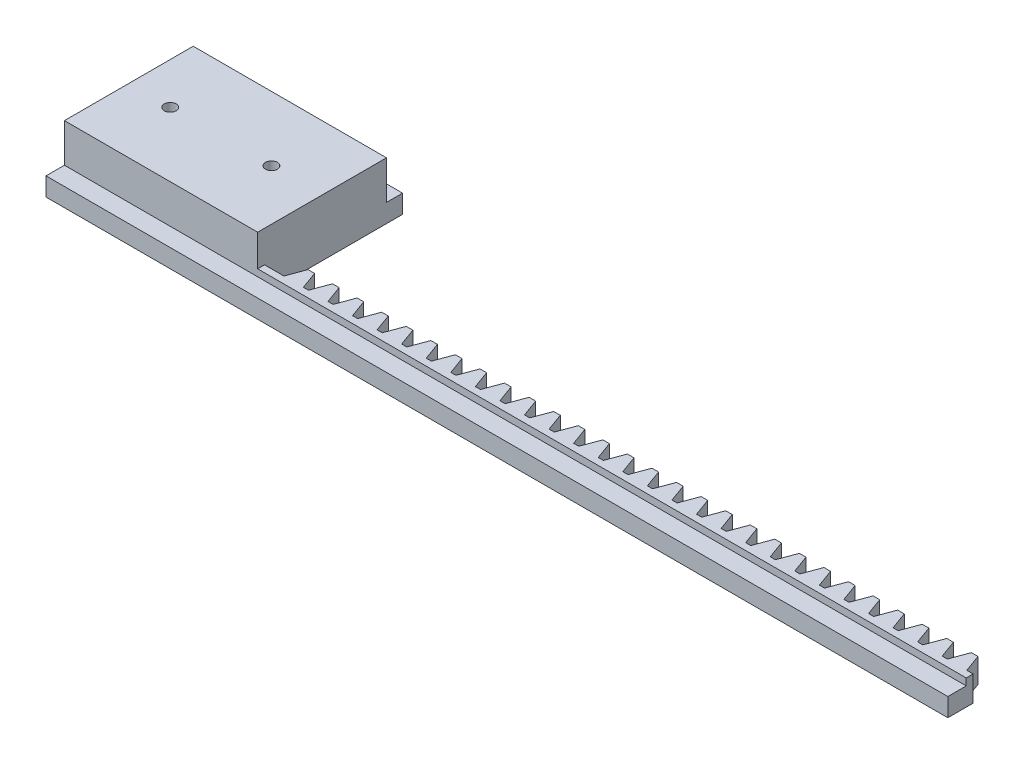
SolidWorks part; units mm, degrees
ref_plane "Front Plane" through (0, 0, 0) normal (0, 0, 1) x (1, 0, 0)
ref_plane "Top Plane" through (0, 0, 0) normal (0, 1, 0) x (1, 0, 0)
ref_plane "Right Plane" through (0, 0, 0) normal (1, 0, 0) x (0, 0, -1)
sketch "Sketch1" plane through (0, 0, 0) normal (0, 1, 0) x (1, 0, 0)
  line L0 (0, 0) -> (50, 0) construction
  line L1 (23.5675, 1.7) -> (25, 1.7)
  line L3 (25, 1.7) -> (26.3922, -2.125)
  line L4 (25, 1.7) -> (25, -12.1658) construction
  line L5 (25.6187, 0) -> (22.9487, 0) construction
  line L6 (24.2837, 0) -> (24.2837, 0.9173) construction
  line L7 (23.5675, 1.7) -> (22.1616, -2.125)
  line L8 (0, 1.7) -> (50, 1.7) construction
  line L9 (28.9075, 1.7) -> (30.34, 1.7)
  line L10 (28.9075, 1.7) -> (27.5016, -2.125)
  line L11 (30.34, 1.7) -> (31.7322, -2.125)
  line L12 (34.2475, 1.7) -> (35.68, 1.7)
  line L13 (34.2475, 1.7) -> (32.8416, -2.125)
  line L14 (35.68, 1.7) -> (37.0722, -2.125)
  line L15 (39.5875, 1.7) -> (41.02, 1.7)
  line L16 (39.5875, 1.7) -> (38.1816, -2.125)
  line L17 (41.02, 1.7) -> (42.4122, -2.125)
  line L18 (44.9275, 1.7) -> (46.36, 1.7)
  line L19 (44.9275, 1.7) -> (43.5216, -2.125)
  line L20 (46.36, 1.7) -> (47.7522, -2.125)
  line L21 (50.2675, 1.7) -> (51.7, 1.7)
  line L22 (50.2675, 1.7) -> (48.8616, -2.125)
  line L23 (51.7, 1.7) -> (53.0922, -2.125)
  line L24 (55.6075, 1.7) -> (57.04, 1.7)
  line L25 (55.6075, 1.7) -> (54.2016, -2.125)
  line L26 (57.04, 1.7) -> (58.4322, -2.125)
  line L27 (60.9475, 1.7) -> (62.38, 1.7)
  line L28 (60.9475, 1.7) -> (59.5416, -2.125)
  line L29 (62.38, 1.7) -> (63.7722, -2.125)
  line L30 (66.2875, 1.7) -> (67.72, 1.7)
  line L31 (66.2875, 1.7) -> (64.8816, -2.125)
  line L32 (67.72, 1.7) -> (69.1122, -2.125)
  line L33 (71.6275, 1.7) -> (73.06, 1.7)
  line L34 (71.6275, 1.7) -> (70.2216, -2.125)
  line L35 (73.06, 1.7) -> (74.4522, -2.125)
  line L36 (76.9675, 1.7) -> (78.4, 1.7)
  line L37 (76.9675, 1.7) -> (75.5616, -2.125)
  line L38 (78.4, 1.7) -> (79.7922, -2.125)
  line L39 (82.3075, 1.7) -> (83.74, 1.7)
  line L40 (82.3075, 1.7) -> (80.9016, -2.125)
  line L41 (83.74, 1.7) -> (85.1322, -2.125)
  line L42 (87.6475, 1.7) -> (89.08, 1.7)
  line L43 (87.6475, 1.7) -> (86.2416, -2.125)
  line L44 (89.08, 1.7) -> (90.4722, -2.125)
  line L45 (92.9875, 1.7) -> (94.42, 1.7)
  line L46 (92.9875, 1.7) -> (91.5816, -2.125)
  line L47 (94.42, 1.7) -> (95.8122, -2.125)
  line L48 (98.3275, 1.7) -> (99.76, 1.7)
  line L49 (98.3275, 1.7) -> (96.9216, -2.125)
  line L50 (99.76, 1.7) -> (101.1522, -2.125)
  line L51 (103.6675, 1.7) -> (105.1, 1.7)
  line L52 (103.6675, 1.7) -> (102.2616, -2.125)
  line L53 (105.1, 1.7) -> (106.4922, -2.125)
  line L54 (109.0075, 1.7) -> (110.44, 1.7)
  line L55 (109.0075, 1.7) -> (107.6016, -2.125)
  line L56 (110.44, 1.7) -> (111.8322, -2.125)
  line L57 (114.3475, 1.7) -> (115.78, 1.7)
  line L58 (114.3475, 1.7) -> (112.9416, -2.125)
  line L59 (115.78, 1.7) -> (117.1722, -2.125)
  line L60 (119.6875, 1.7) -> (121.12, 1.7)
  line L61 (119.6875, 1.7) -> (118.2816, -2.125)
  line L62 (121.12, 1.7) -> (122.5122, -2.125)
  line L63 (125.0275, 1.7) -> (126.46, 1.7)
  line L64 (125.0275, 1.7) -> (123.6216, -2.125)
  line L65 (126.46, 1.7) -> (127.8522, -2.125)
  line L66 (130.3675, 1.7) -> (131.8, 1.7)
  line L67 (130.3675, 1.7) -> (128.9616, -2.125)
  line L68 (131.8, 1.7) -> (133.1922, -2.125)
  line L69 (135.7075, 1.7) -> (137.14, 1.7)
  line L70 (135.7075, 1.7) -> (134.3016, -2.125)
  line L71 (137.14, 1.7) -> (138.5322, -2.125)
  line L72 (141.0475, 1.7) -> (142.48, 1.7)
  line L73 (141.0475, 1.7) -> (139.6416, -2.125)
  line L74 (142.48, 1.7) -> (143.8722, -2.125)
  line L75 (146.3875, 1.7) -> (147.82, 1.7)
  line L76 (146.3875, 1.7) -> (144.9816, -2.125)
  line L77 (147.82, 1.7) -> (149.2122, -2.125)
  line L78 (151.7275, 1.7) -> (153.16, 1.7)
  line L79 (151.7275, 1.7) -> (150.3216, -2.125)
  line L80 (153.16, 1.7) -> (154.5522, -2.125)
  line L81 (157.0675, 1.7) -> (158.5, 1.7)
  line L82 (157.0675, 1.7) -> (155.6616, -2.125)
  line L83 (158.5, 1.7) -> (159.8922, -2.125)
  line L84 (162.4075, 1.7) -> (163.84, 1.7)
  line L85 (162.4075, 1.7) -> (161.0016, -2.125)
  line L86 (163.84, 1.7) -> (165.2322, -2.125)
  line L87 (167.7475, 1.7) -> (169.18, 1.7)
  line L88 (167.7475, 1.7) -> (166.3416, -2.125)
  line L89 (169.18, 1.7) -> (170.5722, -2.125)
  line L91 (17.9487, -2.125) -> (171.9487, -2.125)
  line L92 (17.9487, -2.125) -> (17.9487, -3.625)
  line L93 (17.9487, -3.625) -> (171.9487, -3.625)
  line L94 (171.9487, -2.125) -> (171.9487, -3.625)
  dimension "D1" = 50
  dimension "D4" = 20
  dimension "D5" = 2.67
  dimension "D6" = 28
  dimension "D3" = 2.125
  dimension "D7" = 1.5
  dimension "D8" = 154
  dimension "D9" = 5
  dimension "D2" = 1.7
extrude "Boss-Extrude1" add sketch "Sketch1" along normal mid plane 5.28 contours L94 L91 | L88 L91 L89 L87 | L85 L91 L86 L84 | L82 L91 L83 L81 | L79 L91 L80 L78 | L76 L91 L77 L75 | L73 L91 L74 L72 | L70 L91 L71 L69 | L67 L91 L68 L66 | L64 L91 L65 L63 | L61 L91 L62 L60 | L58 L91 L59 L57 | L55 L91 L56 L54 | L52 L91 L53 L51 | L49 L91 L50 L48 | L46 L91 L47 L45 | L43 L91 L44 L42 | L40 L91 L41 L39 | L37 L91 L38 L36 | L34 L91 L35 L33 | L31 L91 L32 L30 | L28 L91 L29 L27 | L25 L91 L26 L24 | L22 L91 L23 L21 | L19 L91 L20 L18 | L16 L91 L17 L15 | L13 L91 L14 L12 | L10 L91 L11 L9 | L7 L91 L3 L1
sketch "Sketch2" plane through (0, -2.64, 0) normal (0, -1, 0) x (1, 0, 0)
  line L1 (17.9487, 3.625) -> (171.9487, 3.625)
  line L2 (17.9487, 3.625) -> (17.9487, 2.125)
  line L3 (17.9487, 2.125) -> (171.9487, 2.125)
  line L4 (171.9487, 3.625) -> (171.9487, 2.125)
extrude "Boss-Extrude2" add sketch "Sketch2" along normal blind 0.22
sketch "Sketch3" plane through (171.9487, 0, 0) normal (1, 0, 0) x (0, 0, -1)
  line L1 (-3.625, -2.86) -> (-7.625, -2.86)
  line L2 (-3.625, -2.86) -> (-3.625, 1.14)
  line L3 (-3.625, 1.14) -> (-7.625, 1.14)
  line L4 (-7.625, -2.86) -> (-7.625, 1.14)
  dimension "D1" = 4
  dimension "D2" = 4
extrude "Boss-Extrude3" add sketch "Sketch3" against normal blind 154 contours L2 L1 L4 L3
sketch "Sketch10" plane through (0, -2.86, 0) normal (0, -1, 0) x (1, 0, 0)
  line L1 (17.9487, 7.625) -> (-24.0513, 7.625)
  line L2 (17.9487, 7.625) -> (17.9487, -27.875)
  line L3 (17.9487, -27.875) -> (-24.0513, -27.875)
  line L4 (-24.0513, 7.625) -> (-24.0513, -27.875)
  dimension "D1" = 42
  dimension "D2" = 35.5
extrude "Boss-Extrude7" add sketch "Sketch10" against normal blind 4
sketch "Sketch11" plane through (0, 1.14, 0) normal (0, 1, 0) x (1, 0, 0)
  line L0 (-24.0513, -7.625) -> (-24.0513, 27.875) construction
  line L1 (17.9487, -3.625) -> (-24.0513, -3.625)
  line L2 (17.9487, -3.625) -> (17.9487, 24.375)
  line L3 (17.9487, 24.375) -> (-24.0513, 24.375)
  line L4 (-24.0513, -3.625) -> (-24.0513, 24.375)
  line L6 (-24.0513, 27.875) -> (17.9487, 27.875) construction
  dimension "D1" = 3.5
extrude "Boss-Extrude8" add sketch "Sketch11" along normal blind 8.396
sketch "Sketch12" plane through (0, 9.536, 0) normal (0, 1, 0) x (1, 0, 0)
  line L0 (17.9487, 24.375) -> (-24.0513, 24.375) construction
  line L1 (-24.0513, 24.375) -> (-24.0513, -3.625) construction
  line L3 (17.9487, -3.625) -> (17.9487, 24.375) construction
  circle A0 centre (-15.0513, 10.375) radius 1.3
  circle A1 centre (6.9487, 10.375) radius 1.3
  dimension "D1" = 2.6
  dimension "D2" = 2.6
  dimension "D3" = 12.7
  dimension "D4" = 12.7
  dimension "D6" = 9.7
  dimension "D5" = 7.7
extrude "Cut-Extrude3" cut sketch "Sketch12" against normal through all
